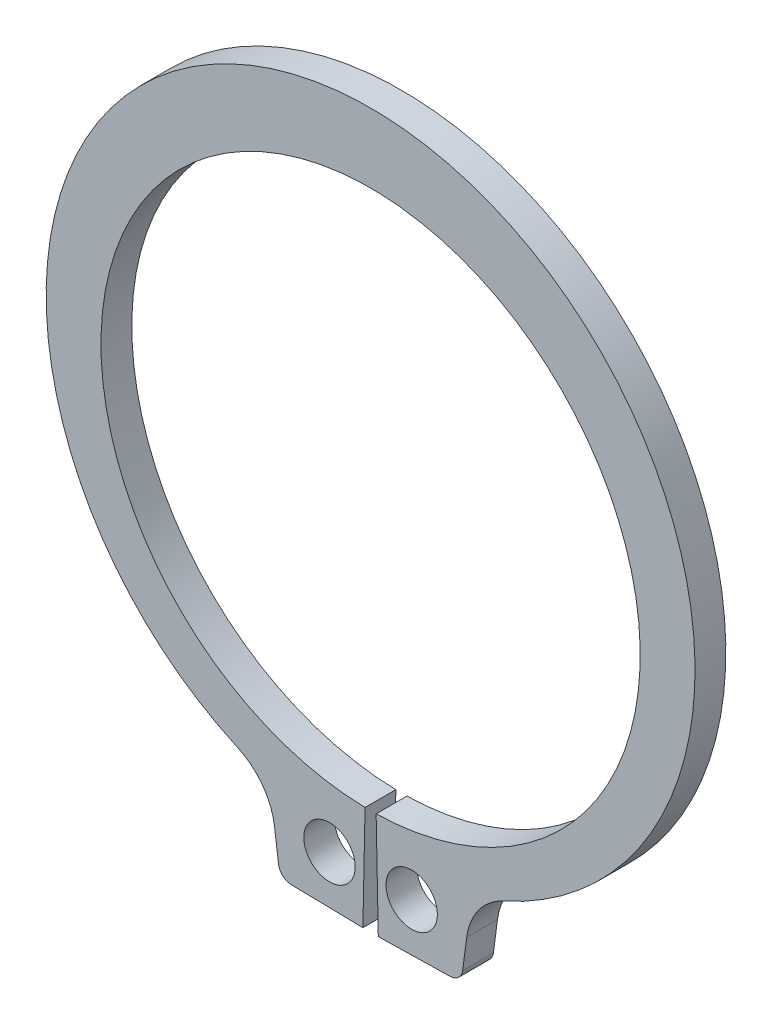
SolidWorks part; units mm, degrees
ref_plane "Plane1" through (0, 0, 0) normal (0, 0, 1) x (1, 0, 0)
ref_plane "Plane2" through (0, 0, 0) normal (0, 1, 0) x (1, 0, 0)
ref_plane "Plane3" through (0, 0, 0) normal (1, 0, 0) x (0, 0, -1)
extrude "Body" add sketch "BodySke" against normal blind 1.2
sketch "BodySke" plane through (0, 0, 0) normal (0, 0, 1) x (1, 0, 0)
  line L0 (-1.5431, 0) -> (1.5431, 0) construction
  line L1 (0, 0) -> (0, 13.2) construction
  line L2 (0.2158, -10.4978) -> (0.3, -14.5969)
  line L3 (-0.2158, -10.4978) -> (-0.3, -14.5969)
  line L4 (0, 0) -> (6.2008, -13.2178) construction
  line L5 (0, 0) -> (-6.2008, -13.2178) construction
  line L6 (0.3, -14.5969) -> (3.0976, -14.5394)
  line L7 (3.7424, -12.8941) -> (3.583, -14.1048)
  line L8 (-3.7424, -12.8941) -> (-3.583, -14.1048)
  line L9 (-0.3, -14.5969) -> (-3.0976, -14.5394)
  circle A0 centre (0, 0) radius 10.5 construction
  arc A1 (0.2158, -10.4978) -> (-0.2158, -10.4978) centre (0, 0) ccw
  arc A2 (5.1475, -10.9726) -> (-5.1475, -10.9726) centre (0, 0.5656) ccw construction
  arc A3 (0.3, -14.5969) -> (3.6561, -14.1348) centre (0, 0) ccw construction
  arc A4 (5.1835, -10.9564) -> (3.7424, -12.8941) centre (6.2008, -13.2178) ccw
  arc A5 (-3.7424, -12.8941) -> (-5.1835, -10.9564) centre (-6.2008, -13.2178) ccw
  arc A6 (-3.6561, -14.1348) -> (-0.3, -14.5969) centre (0, 0) ccw construction
  arc A7 (5.1835, -10.9564) -> (-5.1835, -10.9564) centre (0, 0.5656) ccw
  arc A8 (-3.8321, -12.2129) -> (3.8321, -12.2129) centre (0, 0) ccw construction
  circle A9 centre (1.6, -12.6996) radius 1
  circle A10 centre (-1.6, -12.6996) radius 1
  arc A11 (3.583, -14.1048) -> (3.0976, -14.5394) centre (3.0873, -14.0395) cw
  arc A12 (-3.583, -14.1048) -> (-3.0976, -14.5394) centre (-3.0873, -14.0395) ccw
  point P28 (3.5764, -14.1552)
  point P31 (-3.5764, -14.1552)
  dimension "GrooveDia" = 21
  dimension "D3" = 0.5
  dimension "LugRad" = 14.6
  dimension "HoleOffsetRad" = 12.8
  dimension "HoleDia" = 2
  dimension "D2" = 15
  dimension "LargeRad" = 13.2
  dimension "SmallRad" = 12.12
  dimension "Gap" = 0.6
  dimension "SmallAngle" = 50.265
  dimension "HoleSpacing" = 3.2
sketch "Clipboard" plane through (0, 0, 0) normal (0, 0, 1) x (1, 0, 0)
  line L0 (0, 0) -> (2.7, 0)
  line L1 (0, 0) -> (0, 1.62)
  line L2 (0, 0) -> (0, -4.1)
  circle A0 centre (0, 0) radius 1
  circle A1 centre (0, 0) radius 11
  dimension "HoleDia" = 2
  dimension "ShaftDia" = 22
  dimension "LargeSection" = 2.7
  dimension "SmallSection" = 1.62
  dimension "LugSection" = 4.1
equation "' \"ShaftDia@Clipboard\" = 10"
equation "' \"Thickness@Body\" = 1"
equation "' \"GrooveDia@BodySke\" = 9.6"
equation "' \"LugSection@Clipboard\" = 3.0"
equation "' \"LargeSection@Clipboard\" = 1.6"
equation "' \"HoleDia@Clipboard\" = 1.2"
equation "\"SmallSection@Clipboard\" =  \"LargeSection@Clipboard\" * 0.6"
equation "\"Gap@BodySke\" =  \"Thickness@Body\" / 2"
equation "\"LargeRad@BodySke\" =  \"GrooveDia@BodySke\" / 2 +  \"LargeSection@Clipboard\""
equation "\"SmallRad@BodySke\" =  \"GrooveDia@BodySke\" / 2 +  \"SmallSection@Clipboard\""
equation "\"LugRad@BodySke\" = \"GrooveDia@BodySke\" / 2 + \"LugSection@Clipboard\""
equation "\"HoleOffsetRad@BodySke\" = (  \"ShaftDia@Clipboard\" / 2 + \"LugRad@BodySke\" ) / 2"
equation "\"HoleSpacing@BodySke\" = \"Gap@BodySke\"  * 2 +  \"HoleDia@Clipboard\""
equation "\"HoleDia@BodySke\" =  \"HoleDia@Clipboard\""
equation "\"SmallAngle@BodySke\" = atn(\"HoleSpacing@BodySke\" / 2 / sqr(\"HoleOffsetRad@BodySke\"  * \"HoleOffsetRad@BodySke\" - (\"HoleSpacing@BodySke\" / 2) * (\"HoleSpacing@BodySke\" / 2) ))  * 7 * ( 180 / 3.141593)"
